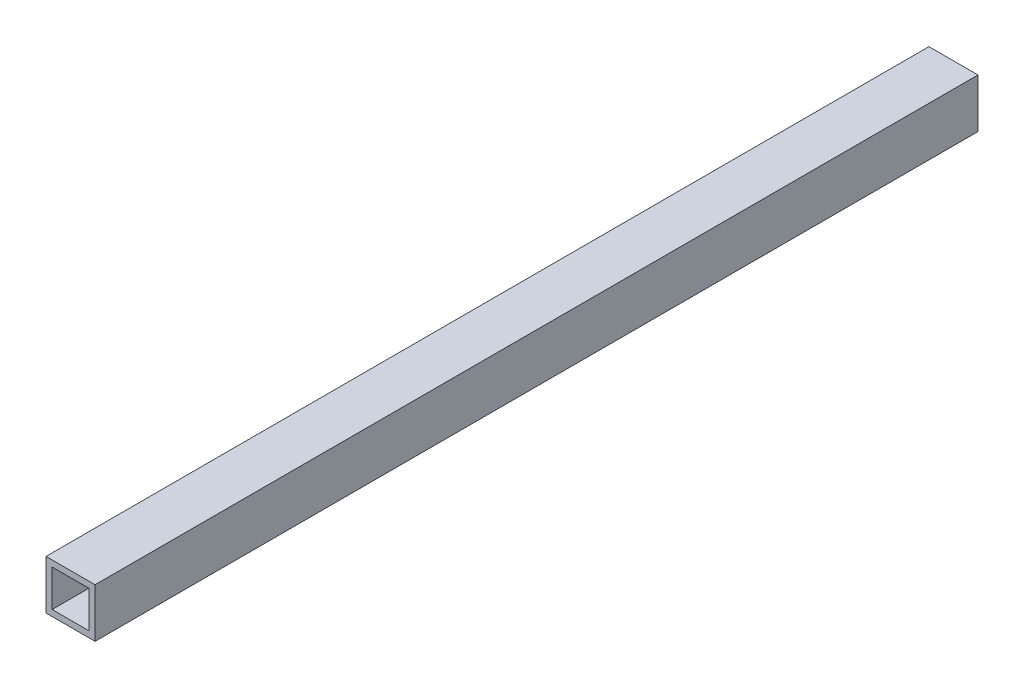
SolidWorks part; units mm, degrees
ref_plane "Plane1" through (0, 0, 0) normal (0, 0, 1) x (1, 0, 0)
ref_plane "Plane2" through (0, 0, 0) normal (0, 1, 0) x (1, 0, 0)
ref_plane "Plane3" through (0, 0, 0) normal (1, 0, 0) x (0, 0, -1)
sketch "Sketch1" plane through (0, 0, 0) normal (0, 0, 1) x (1, 0, 0)
  line L0 (3.175, 3.175) -> (22.225, 3.175)
  line L1 (0, 0) -> (25.4, 0)
  line L2 (0, 0) -> (0, 25.4)
  line L3 (0, 25.4) -> (25.4, 25.4)
  line L4 (25.4, 0) -> (25.4, 25.4)
  line L5 (22.225, 3.175) -> (22.225, 22.225)
  line L6 (3.175, 22.225) -> (22.225, 22.225)
  line L7 (3.175, 3.175) -> (3.175, 22.225)
  dimension "D1" = 25.4
  dimension "D2" = 25.4
  dimension "D3" = 3.175
extrude "Base-Extrude" add sketch "Sketch1" along normal blind 457.2
